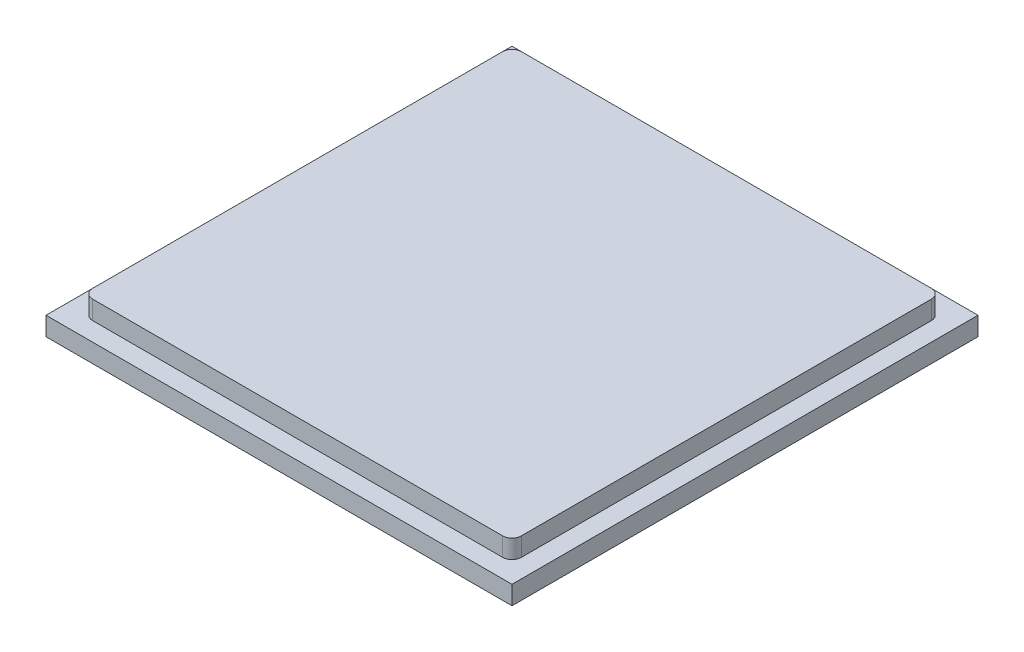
SolidWorks part; units mm, degrees
ref_plane "Front Plane" through (0, 0, 0) normal (0, 0, 1) x (1, 0, 0)
ref_plane "Top Plane" through (0, 0, 0) normal (0, 1, 0) x (1, 0, 0)
ref_plane "Right Plane" through (0, 0, 0) normal (1, 0, 0) x (0, 0, -1)
sketch "Sketch2" plane through (0, 0, 0) normal (0, 1, 0) x (1, 0, 0)
  line L1 (0, 0) -> (63.5, 0)
  line L2 (0, 0) -> (0, 63.5)
  line L3 (0, 63.5) -> (63.5, 63.5)
  line L4 (63.5, 0) -> (63.5, 63.5)
extrude "Boss-Extrude2" add sketch "Sketch2" along normal blind 2.54
sketch "Sketch3" plane through (0, 2.54, 0) normal (0, 1, 0) x (1, 0, 0)
  line L0 (0, 0) -> (0, 2.54)
  line L1 (0, 63.5) -> (0, 0) construction
  line L2 (0, 2.54) -> (2.54, 2.54)
  line L3 (63.5, 63.5) -> (60.96, 63.5)
  line L4 (63.5, 63.5) -> (0, 63.5) construction
  line L5 (60.96, 63.5) -> (60.96, 60.96)
  line L7 (3.81, 2.54) -> (59.69, 2.54)
  line L8 (2.54, 3.81) -> (2.54, 59.69)
  line L9 (3.81, 60.96) -> (59.69, 60.96)
  line L10 (60.96, 3.81) -> (60.96, 59.69)
  arc A0 (59.69, 60.96) -> (60.96, 59.69) centre (59.69, 59.69) cw
  arc A1 (59.69, 2.54) -> (60.96, 3.81) centre (59.69, 3.81) ccw
  arc A2 (3.81, 2.54) -> (2.54, 3.81) centre (3.81, 3.81) cw
  arc A3 (2.54, 59.69) -> (3.81, 60.96) centre (3.81, 59.69) cw
  dimension "D1" = 1.27
extrude "Boss-Extrude3" add sketch "Sketch3" along normal blind 2.54 contours A3 L8 A2 L7 A1 L10 A0 L9
